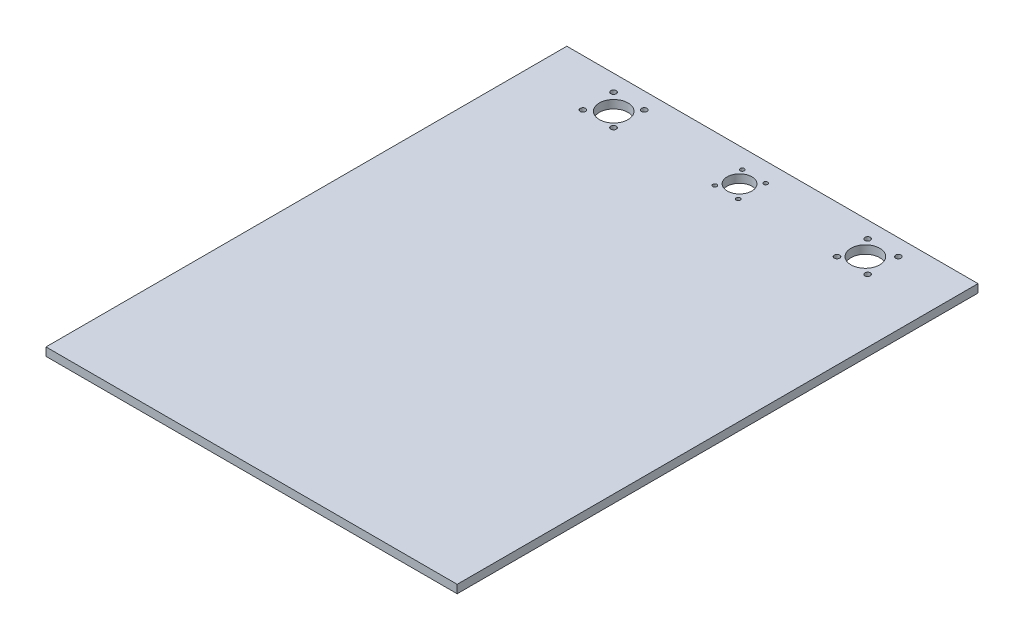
SolidWorks part; units mm, degrees
ref_plane "Front Plane" through (0, 0, 0) normal (0, 0, 1) x (1, 0, 0)
ref_plane "Top Plane" through (0, 0, 0) normal (0, 1, 0) x (1, 0, 0)
ref_plane "Right Plane" through (0, 0, 0) normal (1, 0, 0) x (0, 0, -1)
sketch "Sketch1" plane through (0, 0, 0) normal (0, 1, 0) x (1, 0, 0)
  line L0 (0, 68.18) -> (0, 0) construction
  line L1 (-150, 190) -> (150, 190)
  line L2 (-150, 190) -> (-150, -190)
  line L3 (-150, -190) -> (150, -190)
  line L4 (150, 190) -> (150, -190)
  line L5 (-150, 190) -> (150, -190) construction
  line L6 (-150, -190) -> (150, 190) construction
  circle A0 centre (0, 166) radius 9
  circle A1 centre (-91.8, 166) radius 10.5
  circle A2 centre (91.8, 166) radius 10.5
  circle A3 centre (-103.9, 178) radius 2
  circle A4 centre (-81.5, 178) radius 2
  circle A7 centre (-103.9, 155.6) radius 2
  circle A8 centre (-81.5, 155.6) radius 2
  circle A9 centre (103.9, 178) radius 2
  circle A10 centre (103.9, 155.6) radius 2
  circle A11 centre (81.5, 155.6) radius 2
  circle A12 centre (81.5, 178) radius 2
  circle A13 centre (-8, 176) radius 1.5
  circle A14 centre (9.1, 176) radius 1.5
  circle A15 centre (9.1, 156) radius 1.5
  circle A16 centre (-8, 156) radius 1.5
  point P0 (0, 0)
  dimension "D3" = 21
  dimension "D4" = 18
  dimension "D5" = 21
  dimension "D7" = 166
  dimension "D9" = 91.8
  dimension "D12" = 4
  dimension "D13" = 4
  dimension "D14" = 4
  dimension "D15" = 4
  dimension "D20" = 3
  dimension "D21" = 3
  dimension "D22" = 3
  dimension "D23" = 3
  dimension "D25" = 8
  dimension "D26" = 17.1
  dimension "D27" = 20
  dimension "D28" = 17.1
  dimension "D1" = 300
  dimension "D2" = 380
  dimension "D6" = 24
  dimension "D8" = 91.8
  dimension "D10" = 12
  dimension "D11" = 12
  dimension "D16" = 12.1
  dimension "D17" = 22.4
  dimension "D18" = 22.4
  dimension "D19" = 22.4
  dimension "D24" = 14
extrude "Boss-Extrude1" add sketch "Sketch1" along normal blind 6
